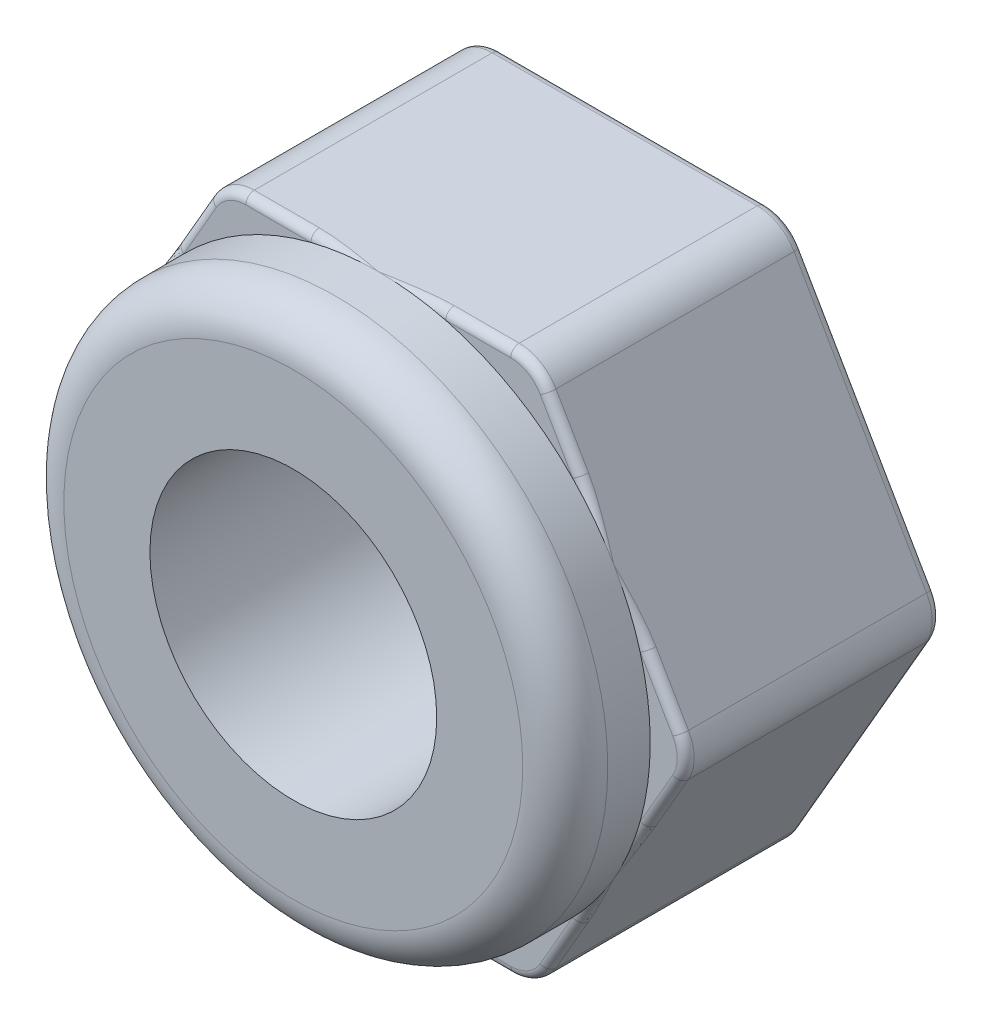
SolidWorks part; units mm, degrees
ref_plane "Plan1" through (0, 0, 0) normal (0, 0, 1) x (1, 0, 0)
ref_plane "Plan2" through (0, 0, 0) normal (0, 1, 0) x (1, 0, 0)
ref_plane "Plan3" through (0, 0, 0) normal (1, 0, 0) x (0, 0, -1)
sketch "Esquisse1" plane through (0, 0, 0) normal (0, 0, 1) x (1, 0, 0)
  line L1 (7.3901, 0) -> (3.695, 6.4)
  line L2 (3.695, 6.4) -> (-3.695, 6.4)
  line L3 (-3.695, 6.4) -> (-7.3901, 0)
  line L4 (-7.3901, 0) -> (-3.695, -6.4)
  line L5 (-3.695, -6.4) -> (3.695, -6.4)
  line L6 (-48.544, 0) -> (48.544, 0) construction
  line L7 (0, 30.4512) -> (0, -30.4512) construction
  line L8 (3.695, -6.4) -> (7.3901, 0)
  circle A0 centre (0, 0) radius 6.4 construction
  circle A1 centre (0, 0) radius 3.375
  dimension "D3" = 6.75
  dimension "D1" = 12.8
extrude "Base-Extrusion" add sketch "Esquisse1" along normal blind 6
sketch "Esquisse2" plane through (0, 0, 6) normal (0, 0, 1) x (1, 0, 0)
  line L1 (3.695, 6.4) -> (-3.695, 6.4) construction
  circle A0 centre (0, 0) radius 6.4
  circle A1 centre (0, 0) radius 3.375
  circle A2 centre (0, 0) radius 3.375 construction
extrude "Boss.-Extru.1" add sketch "Esquisse2" along normal blind 2
fillet "Congé2" radius 1
fillet "Congé3" radius 0.2
